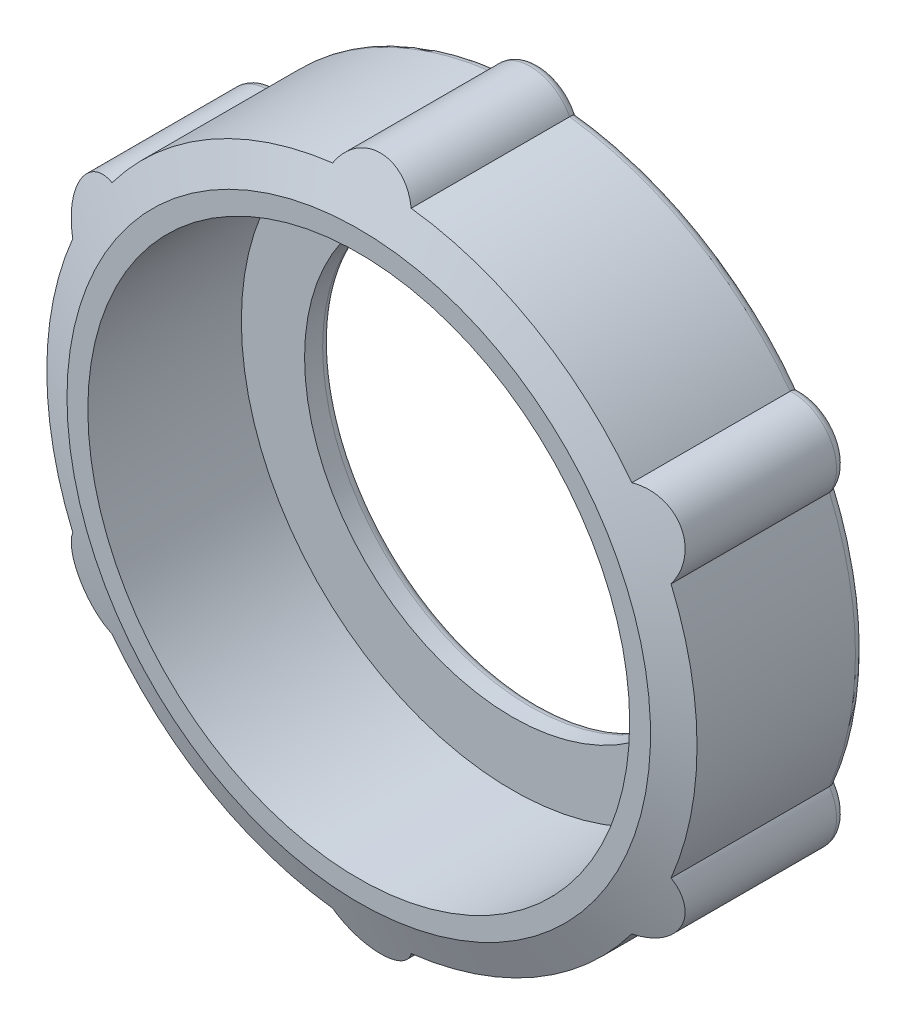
SolidWorks part; units mm, degrees
ref_plane "Plane1" through (0, 0, 0) normal (0, 0, 1) x (1, 0, 0)
ref_plane "Plane2" through (0, 0, 0) normal (0, 1, 0) x (1, 0, 0)
ref_plane "Plane3" through (0, 0, 0) normal (1, 0, 0) x (0, 0, -1)
sketch "Sketch1" plane through (0, 0, 0) normal (0, 0, 1) x (1, 0, 0)
  circle A0 centre (0, 0) radius 36
  dimension "D1" = 72
extrude "Base-Extrude" add sketch "Sketch1" along normal blind 20
sketch "Sketch2" plane through (0, 0, 20) normal (0, 0, 1) x (1, 0, 0)
  circle A0 centre (0, 0) radius 30
  dimension "D1" = 60
extrude "Cut-Extrude1" cut sketch "Sketch2" against normal blind 17
sketch "Sketch3" plane through (0, 0, 0) normal (0, 0, -1) x (-1, 0, 0)
  circle A0 centre (0, 0) radius 23
  dimension "D1" = 46
extrude "Cut-Extrude2" cut sketch "Sketch3" against normal blind 17
sketch "Sketch4" plane through (-0.0419, -1.5923, 0) normal (0, 0, -1) x (-1, 0, 0)
  line L0 (0, 0) -> (0, 39.6178) construction
  line L1 (-4.9231, 35.1077) -> (4.84, 35.1077)
  arc A0 (-4.9231, 35.1077) -> (4.84, 35.1077) centre (-0.0415, 35.1077) cw
extrude "Boss-Extrude1" add sketch "Sketch4" against normal blind 20
pattern_circular "CirPattern1" count 6 every 60
sketch "Sketch6" plane through (0, 0, 0) normal (0, 1, 0) x (1, 0, 0)
  line L0 (49.8302, -13.0811) -> (32.308, -20)
  line L2 (32.308, -20) -> (51.5788, -29.0584)
  line L3 (51.5788, -29.0584) -> (49.8302, -13.0811)
  line L4 (0, 0) -> (0, -7.497) construction
  line L8 (28.7751, -20) -> (33.9066, -20) construction
revolve "Cut-Revolve1" cut sketch "Sketch6" angle 360 about L4
fillet "Fillet1" radius 1
